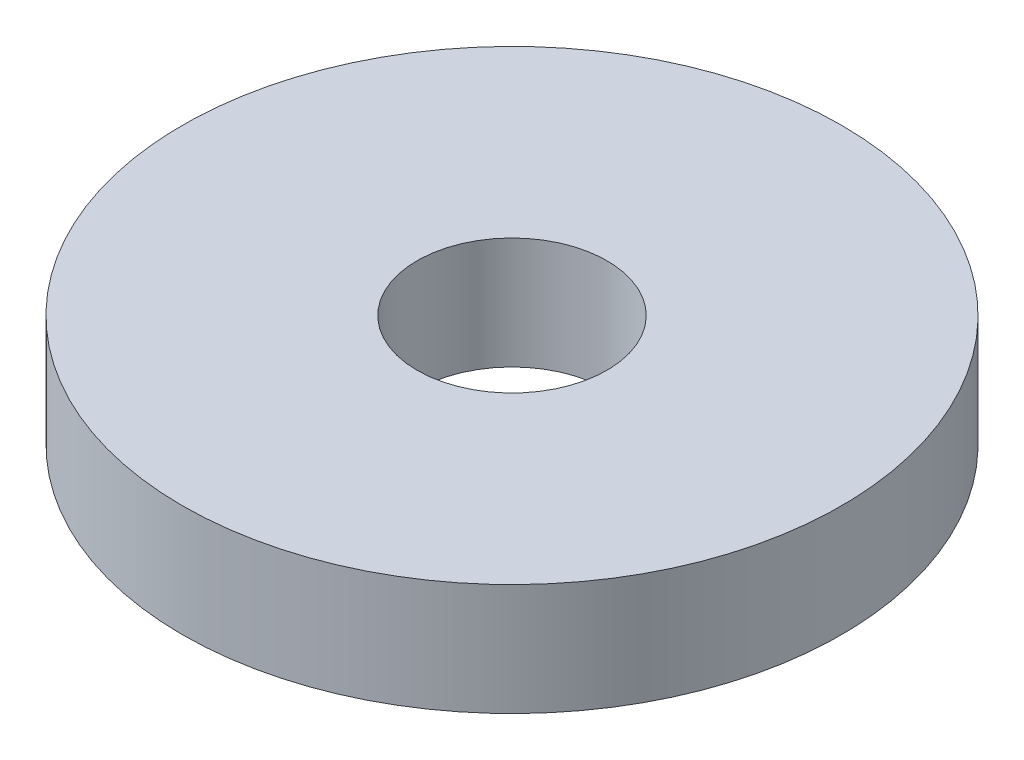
SolidWorks part; units mm, degrees
ref_plane "Face" through (0, 0, 0) normal (0, 0, 1) x (1, 0, 0)
ref_plane "Dessus" through (0, 0, 0) normal (0, 1, 0) x (1, 0, 0)
ref_plane "Droite" through (0, 0, 0) normal (1, 0, 0) x (0, 0, -1)
sketch "Esquisse1" plane through (0, 0, 0) normal (0, 1, 0) x (1, 0, 0)
  circle A0 centre (0, 0) radius 29.5
  circle A1 centre (0, 0) radius 8.5
  dimension "D1" = 59
  dimension "D2" = 17
extrude "Extrusion1" add sketch "Esquisse1" along normal blind 10
